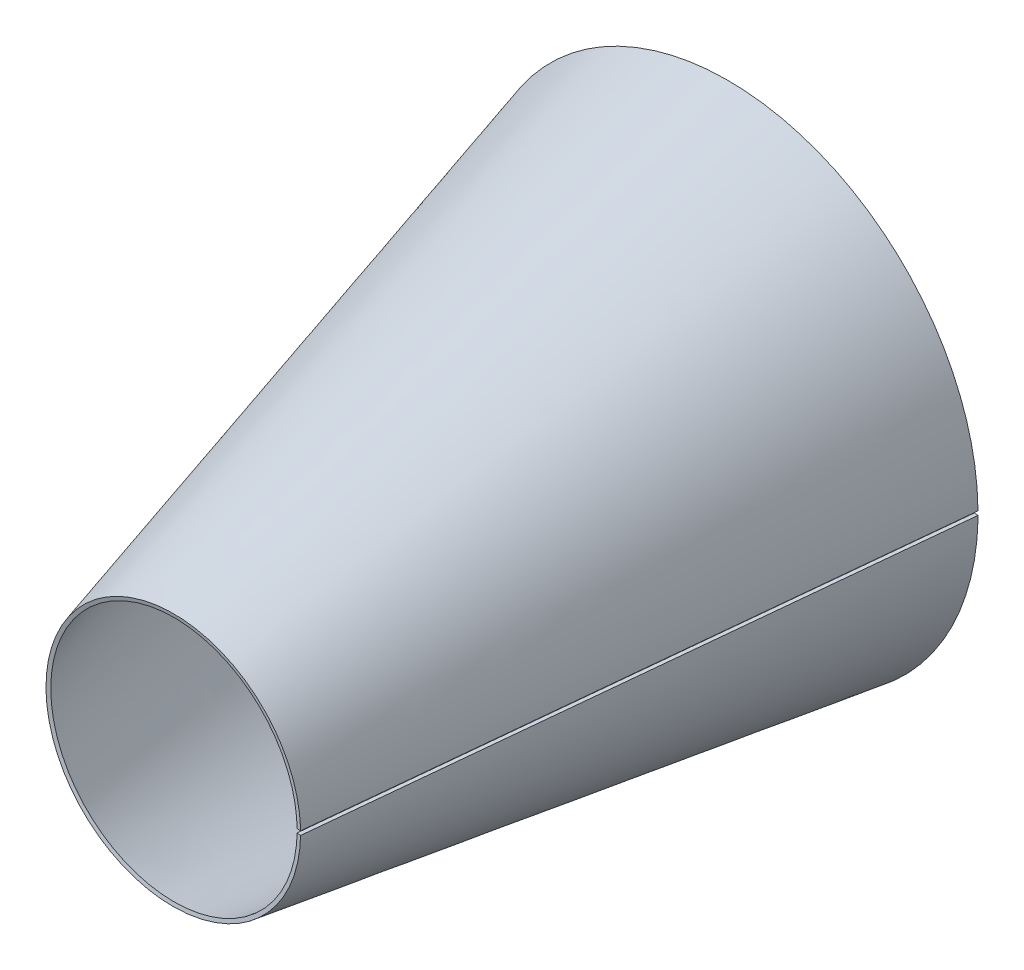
SolidWorks part; units mm, degrees
ref_plane "Front" through (0, 0, 0) normal (0, 0, 1) x (1, 0, 0)
ref_plane "Top" through (0, 0, 0) normal (0, 1, 0) x (1, 0, 0)
ref_plane "Right" through (0, 0, 0) normal (1, 0, 0) x (0, 0, -1)
sketch "ClipBoard" plane through (0, 0, 0) normal (1, 0, 0) x (0, 0, -1)
  line L0 (0, 0) -> (1.5875, 0) construction
  line L1 (0, 0) -> (0, 1.5875) construction
sketch "Inlet" plane through (0, 0, 0) normal (0, 0, 1) x (1, 0, 0)
  line L0 (0, 0) -> (70, 0) construction
  line L1 (0, -0.7937) -> (130, -0.7937) construction
  line L2 (0, 0.7937) -> (130, 0.7937) construction
  arc A0 (101.5969, 0.7937) -> (101.5969, -0.7937) centre (0, 0) ccw
ref_plane "ExitPlane" through (0, 0, 254) normal (0, 0, 1) x (1, 0, 0)
sketch "Outlet" plane through (0, 0, 254) normal (0, 0, 1) x (1, 0, 0)
  line L0 (0, 0.7937) -> (130, 0.7937) construction
  line L1 (0, -0.7937) -> (130, -0.7937) construction
  line L2 (0, 0.7937) -> (130, 0.7937) construction
  line L3 (0, -0.7937) -> (130, -0.7937) construction
  arc A0 (76.1938, 0.7937) -> (76.1938, -0.7937) centre (25.4, 0) ccw
  dimension "Diameter" = 101.6
  dimension "Offset" = 25.4
sheet metal parameters "Sheet-Metal1" thickness 1.5875 parameters "D1"=0.7937
lofted bend "Transition" parameters "D1"=0, "D12"=1
other "Freeform Bend1" parameters "D1"=1000, "D4"=57.296, "D5"=1
flat pattern "Flat-Pattern1"
sketch "Bend-Lines1" plane through (0, 0, 0) normal (0, 1, 0) x (-1, 0, 0)
other "Flatten-<Freeform Bend1>1"
equation "\"Gap@ClipBoard\" = \"Thickness@ClipBoard\" * 1.0"
equation "\"HalfGap@Inlet\" = \"Gap@ClipBoard\" / 2"
